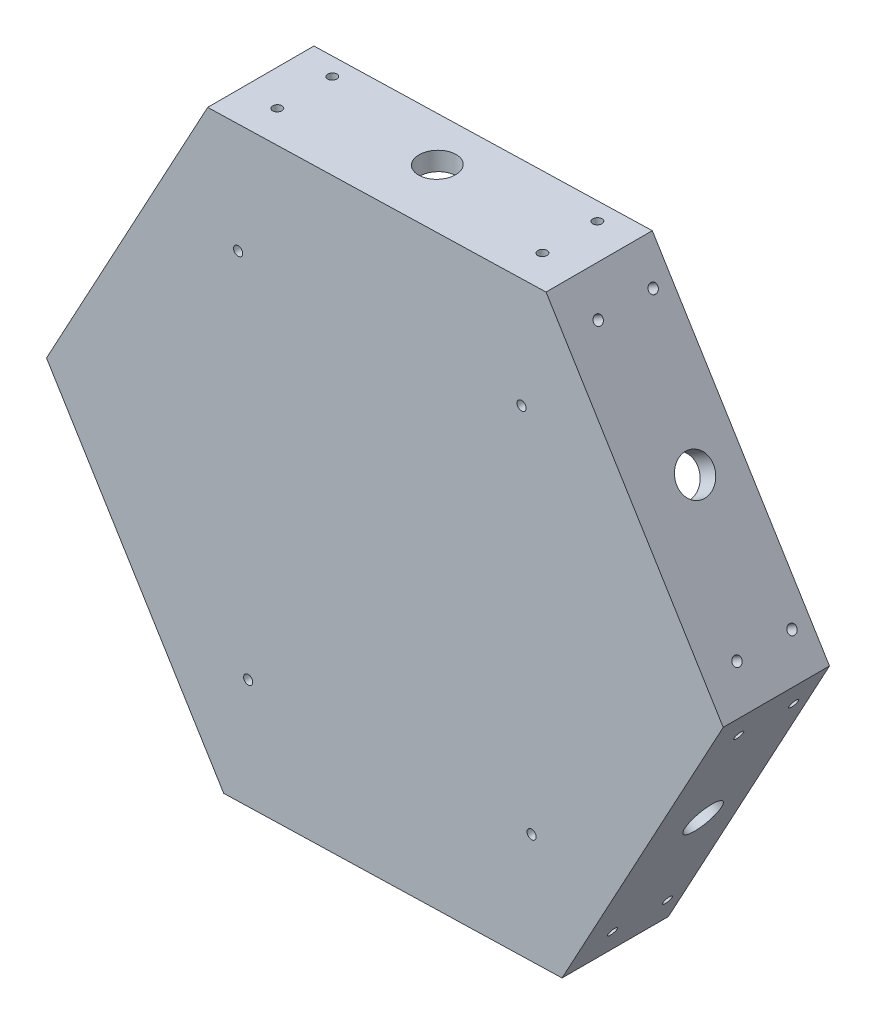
SolidWorks part; units mm, degrees
ref_plane "Front Plane" through (0, 0, 0) normal (0, 0, 1) x (1, 0, 0)
ref_plane "Top Plane" through (0, 0, 0) normal (0, 1, 0) x (1, 0, 0)
ref_plane "Right Plane" through (0, 0, 0) normal (1, 0, 0) x (0, 0, -1)
sketch "Sketch2" plane through (0, 0, 0) normal (0, 0, 1) x (1, 0, 0)
  line L1 (117.2738, 3.2043) -> (55.8619, 103.1643)
  line L2 (55.8619, 103.1643) -> (-61.4119, 99.9599)
  line L3 (-61.4119, 99.9599) -> (-117.2738, -3.2043)
  line L4 (-117.2738, -3.2043) -> (-55.8619, -103.1643)
  line L5 (-55.8619, -103.1643) -> (61.4119, -99.9599)
  line L6 (61.4119, -99.9599) -> (117.2738, 3.2043)
  line L7 (52.3705, 96.7165) -> (-57.5737, 93.7124)
  line L8 (-57.5737, 93.7124) -> (-109.9442, -3.0041)
  line L9 (-109.9442, -3.0041) -> (-52.3705, -96.7165)
  line L10 (-52.3705, -96.7165) -> (57.5737, -93.7124)
  line L11 (57.5737, -93.7124) -> (109.9442, 3.0041)
  line L12 (109.9442, 3.0041) -> (52.3705, 96.7165)
  circle A0 centre (0, 0) radius 101.6 construction
  circle A1 centre (0, 0) radius 95.25 construction
  dimension "D1" = 203.2
  dimension "D2" = 190.5
extrude "Boss-Extrude1" add sketch "Sketch2" along normal blind 31.75
sketch "Sketch3" plane through (2.775, -101.5621, 0) normal (0.0273, -0.9996, 0) x (0.9996, 0.0273, 0)
  line L0 (-45.9588, 25.4) -> (45.9588, 25.4) construction
  line L1 (45.9588, 25.4) -> (45.9588, 6.35) construction
  line L2 (45.9588, 6.35) -> (-45.9588, 6.35) construction
  line L3 (-45.9588, 6.35) -> (-45.9588, 25.4) construction
  line L4 (-58.6588, 31.75) -> (58.6588, 31.75) construction
  line L5 (-58.6588, 0) -> (58.6588, 0) construction
  line L6 (58.6588, 31.75) -> (58.6588, 0) construction
  line L7 (-58.6588, 31.75) -> (-58.6588, 0) construction
  line L8 (-45.9588, 6.35) -> (45.9588, 25.4) construction
  line L9 (-45.9588, 25.4) -> (45.9588, 6.35) construction
  circle A0 centre (-45.9588, 25.4) radius 1.5875
  circle A1 centre (-45.9588, 6.35) radius 1.5875
  circle A2 centre (45.9588, 25.4) radius 1.5875
  circle A3 centre (45.9588, 6.35) radius 1.5875
  circle A4 centre (0, 15.875) radius 6.35
  dimension "D5" = 3.175
  dimension "D6" = 3.175
  dimension "D7" = 3.175
  dimension "D8" = 3.175
  dimension "D9" = 12.7
  dimension "D1" = 6.35
  dimension "D2" = 6.35
  dimension "D3" = 12.7
  dimension "D4" = 12.7
sketch "Sketch4" plane through (89.3429, -48.3778, 0) normal (0.8794, -0.4762, 0) x (0, 0, -1)
  line L0 (-25.4, 45.9588) -> (-6.35, 45.9588) construction
  line L1 (-6.35, 45.9588) -> (-6.35, -45.9588) construction
  line L2 (-6.35, -45.9588) -> (-25.4, -45.9588) construction
  line L3 (-25.4, -45.9588) -> (-25.4, 45.9588) construction
  line L4 (-25.4, 45.9588) -> (-6.35, -45.9588) construction
  line L5 (-6.35, 45.9588) -> (-25.4, -45.9588) construction
  line L6 (-31.75, 58.6588) -> (0, 58.6588) construction
  line L7 (-31.75, -58.6588) -> (0, -58.6588) construction
  line L8 (0, -58.6588) -> (0, 58.6588) construction
  line L9 (-31.75, -58.6588) -> (-31.75, 58.6588) construction
  dimension "D1" = 12.7
  dimension "D2" = 12.7
  dimension "D3" = 6.35
  dimension "D4" = 6.35
sketch "Sketch5" plane through (86.5678, 53.1843, 0) normal (0.852, 0.5235, 0) x (0, 0, -1)
  line L0 (-25.4, 45.9588) -> (-6.35, 45.9588) construction
  line L1 (-6.35, 45.9588) -> (-6.35, -45.9588) construction
  line L2 (-6.35, -45.9588) -> (-25.4, -45.9588) construction
  line L3 (-25.4, -45.9588) -> (-25.4, 45.9588) construction
  line L4 (-25.4, 45.9588) -> (-6.35, -45.9588) construction
  line L5 (-25.4, -45.9588) -> (-6.35, 45.9588) construction
  line L6 (-31.75, 58.6588) -> (0, 58.6588) construction
  line L7 (-31.75, -58.6588) -> (0, -58.6588) construction
  line L8 (0, -58.6588) -> (0, 58.6588) construction
  line L9 (-31.75, -58.6588) -> (-31.75, 58.6588) construction
  circle A0 centre (-25.4, 45.9588) radius 1.5875
  circle A1 centre (-6.35, 45.9588) radius 1.5875
  circle A2 centre (-25.4, -45.9588) radius 1.5875
  circle A3 centre (-6.35, -45.9588) radius 1.5875
  circle A4 centre (-15.875, 0) radius 6.35
  dimension "D5" = 3.175
  dimension "D6" = 3.175
  dimension "D7" = 12.7
  dimension "D8" = 3.175
  dimension "D9" = 3.175
  dimension "D1" = 12.7
  dimension "D2" = 12.7
  dimension "D3" = 6.35
  dimension "D4" = 6.35
sketch "Sketch6" plane through (-2.775, 101.5621, 0) normal (-0.0273, 0.9996, 0) x (0.9996, 0.0273, 0)
  line L0 (-45.9588, -6.35) -> (45.9588, -6.35) construction
  line L1 (45.9588, -6.35) -> (45.9588, -25.4) construction
  line L2 (45.9588, -25.4) -> (-45.9588, -25.4) construction
  line L3 (-45.9588, -25.4) -> (-45.9588, -6.35) construction
  line L4 (-45.9588, -6.35) -> (45.9588, -25.4) construction
  line L5 (45.9588, -6.35) -> (-45.9588, -25.4) construction
  line L6 (58.6588, -31.75) -> (58.6588, 0) construction
  line L7 (-58.6588, -31.75) -> (-58.6588, 0) construction
  line L8 (58.6588, -31.75) -> (-58.6588, -31.75) construction
  line L9 (58.6588, 0) -> (-58.6588, 0) construction
  dimension "D1" = 12.7
  dimension "D2" = 12.7
  dimension "D3" = 6.35
  dimension "D4" = 6.35
sketch "Sketch7" plane through (-89.3429, 48.3778, 0) normal (-0.8794, 0.4762, 0) x (0, 0, 1)
  line L0 (6.35, 45.9588) -> (25.4, 45.9588) construction
  line L1 (25.4, 45.9588) -> (25.4, -45.9588) construction
  line L5 (25.4, -45.9588) -> (6.35, -45.9588) construction
  line L6 (6.35, -45.9588) -> (6.35, 45.9588) construction
  line L7 (6.35, 45.9588) -> (25.4, -45.9588) construction
  line L8 (25.4, 45.9588) -> (6.35, -45.9588) construction
  line L9 (31.75, 58.6588) -> (0, 58.6588) construction
  line L10 (31.75, -58.6588) -> (0, -58.6588) construction
  line L11 (31.75, 58.6588) -> (31.75, -58.6588) construction
  line L12 (0, 58.6588) -> (0, -58.6588) construction
  circle A0 centre (6.35, 45.9588) radius 1.5875
  circle A1 centre (25.4, 45.9588) radius 1.5875
  circle A2 centre (6.35, -45.9588) radius 1.5875
  circle A3 centre (25.4, -45.9588) radius 1.5875
  circle A4 centre (15.875, 0) radius 6.35
  dimension "D5" = 3.175
  dimension "D6" = 3.175
  dimension "D7" = 12.7
  dimension "D8" = 3.175
  dimension "D9" = 3.175
  dimension "D1" = 12.7
  dimension "D2" = 12.7
  dimension "D3" = 6.35
  dimension "D4" = 6.35
sketch "Sketch8" plane through (-86.5678, -53.1843, 0) normal (-0.852, -0.5235, 0) x (0, 0, 1)
  line L0 (6.35, 45.9588) -> (25.4, 45.9588) construction
  line L1 (25.4, 45.9588) -> (25.4, -45.9588) construction
  line L2 (25.4, -45.9588) -> (6.35, -45.9588) construction
  line L3 (6.35, -45.9588) -> (6.35, 45.9588) construction
  line L4 (6.35, 45.9588) -> (25.4, -45.9588) construction
  line L5 (25.4, 45.9588) -> (6.35, -45.9588) construction
  line L6 (31.75, 58.6588) -> (0, 58.6588) construction
  line L7 (31.75, -58.6588) -> (0, -58.6588) construction
  line L8 (31.75, 58.6588) -> (31.75, -58.6588) construction
  line L9 (0, 58.6588) -> (0, -58.6588) construction
  dimension "D1" = 12.7
  dimension "D2" = 12.7
  dimension "D3" = 6.35
  dimension "D4" = 6.35
sketch "Sketch11" plane through (0, 0, 31.75) normal (0, 0, 1) x (1, 0, 0)
  line L1 (55.8619, 103.1643) -> (-61.4119, 99.9599)
  line L2 (-61.4119, 99.9599) -> (-117.2738, -3.2043)
  line L3 (-117.2738, -3.2043) -> (-55.8619, -103.1643)
  line L4 (-55.8619, -103.1643) -> (61.4119, -99.9599)
  line L5 (61.4119, -99.9599) -> (117.2738, 3.2043)
  line L6 (117.2738, 3.2043) -> (55.8619, 103.1643)
  circle A0 centre (0, 0) radius 101.6 construction
extrude "Boss-Extrude2" add sketch "Sketch11" along normal blind 5.08
sketch "Sketch13" plane through (0, 0, 36.83) normal (0, 0, 1) x (1, 0, 0)
  line L0 (-61.4119, 99.9599) -> (-55.8619, -103.1643) construction
  line L1 (-55.8619, -103.1643) -> (61.4119, -99.9599) construction
  line L2 (61.4119, -99.9599) -> (55.8619, 103.1643) construction
  line L3 (55.8619, 103.1643) -> (-61.4119, 99.9599) construction
  line L4 (-50.8499, 62.1343) -> (47.3811, 64.8183) construction
  line L5 (-47.3811, -64.8183) -> (50.8499, -62.1343) construction
  line L6 (-50.8499, 62.1343) -> (-47.3811, -64.8183) construction
  line L7 (47.3811, 64.8183) -> (50.8499, -62.1343) construction
  circle A0 centre (-50.8499, 62.1343) radius 1.5875
  circle A1 centre (47.3811, 64.8183) radius 1.5875
  circle A2 centre (-47.3811, -64.8183) radius 1.5875
  circle A3 centre (50.8499, -62.1343) radius 1.5875
  dimension "D4" = 3.175
  dimension "D5" = 3.175
  dimension "D6" = 3.175
  dimension "D7" = 3.175
  dimension "D1" = 38.1
  dimension "1.5" = 38.1
  dimension "D2" = 9.525
  dimension "D3" = 9.525
extrude "Cut-Extrude1" cut sketch "Sketch3" against normal through all
extrude "Cut-Extrude2" cut sketch "Sketch5" against normal through all
extrude "Cut-Extrude3" cut sketch "Sketch7" against normal through all
extrude "Cut-Extrude4" cut sketch "Sketch13" against normal up to next
sketch "Sketch15" plane through (0, 0, 31.75) normal (0, 0, -1) x (-1, 0, 0)
  circle A0 centre (0, 0) radius 22.225
  dimension "D1" = 44.45
extrude "Boss-Extrude3" add sketch "Sketch15" along normal blind 5.08
